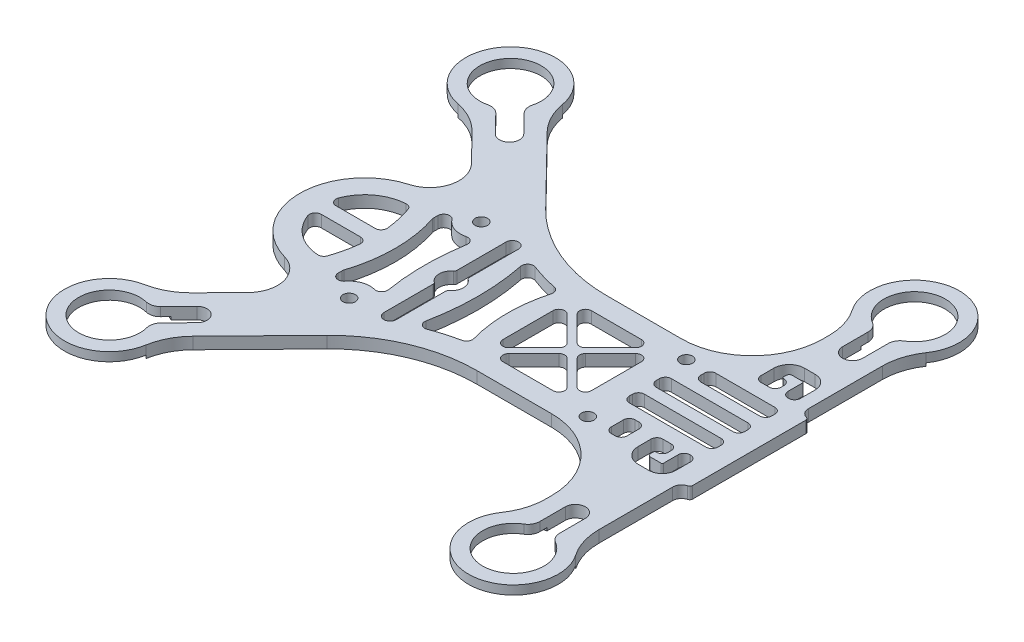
SolidWorks part; units mm, degrees
ref_plane "Plan de face" through (0, 0, 0) normal (0, 0, 1) x (1, 0, 0)
ref_plane "Plan de dessus" through (0, 0, 0) normal (0, 1, 0) x (1, 0, 0)
ref_plane "Plan de droite" through (0, 0, 0) normal (1, 0, 0) x (0, 0, -1)
sketch "Esquisse1" plane through (0, 0, 0) normal (0, 1, 0) x (1, 0, 0)
  line L0 (1870.1298, 1169.8498) -> (1870.1298, 1174.1732)
  line L1 (1866.7298, 1174.1732) -> (1866.7298, 1169.8498)
  line L2 (1803.0538, 1169.2774) -> (1806.0769, 1172.3681)
  line L3 (1808.5075, 1169.9907) -> (1805.4843, 1166.9)
  line L4 (1810.1424, 1227.6886) -> (1821.3877, 1216.192)
  line L5 (1839.2596, 1208.6732) -> (1851.9298, 1208.6732)
  line L6 (1863.9298, 1220.6732) -> (1863.9298, 1221.6977)
  line L7 (1872.9298, 1221.6977) -> (1872.9298, 1209.1732)
  line L8 (1874.3956, 1207.2459) -> (1874.3956, 1197.6732)
  line L9 (1874.3956, 1197.6732) -> (1874.3956, 1188.1006)
  line L10 (1872.9298, 1186.1732) -> (1872.9298, 1173.6487)
  line L11 (1863.9298, 1173.6487) -> (1863.9298, 1174.6732)
  line L12 (1851.9298, 1186.6732) -> (1839.2596, 1186.6732)
  line L13 (1821.3877, 1179.1545) -> (1810.1424, 1167.6578)
  line L14 (1803.7085, 1173.9511) -> (1808.4335, 1178.7817)
  line L15 (1808.4335, 1216.5647) -> (1803.7085, 1221.3953)
  line L16 (1870.1298, 1225.4966) -> (1870.1298, 1221.1732)
  line L17 (1866.7298, 1221.1732) -> (1866.7298, 1225.4966)
  line L18 (1803.0538, 1226.069) -> (1806.0769, 1222.9783)
  line L19 (1808.5075, 1225.3557) -> (1805.4843, 1228.4464)
  line L20 (1864.0564, 1212.1905) -> (1864.0564, 1210.0077)
  line L21 (1865.0564, 1209.0077) -> (1866.4564, 1209.0077)
  line L22 (1867.4564, 1210.0077) -> (1867.4564, 1210.4905)
  line L23 (1866.4564, 1211.4905) -> (1866.3564, 1211.4905)
  line L24 (1866.1564, 1211.6905) -> (1866.1564, 1212.1905)
  line L25 (1866.6564, 1212.6905) -> (1868.4564, 1212.6905)
  line L26 (1868.6564, 1212.4905) -> (1868.6564, 1210.0077)
  line L27 (1869.6564, 1209.0077) -> (1869.7564, 1209.0077)
  line L28 (1870.7564, 1210.0077) -> (1870.7564, 1212.4905)
  line L29 (1868.4564, 1214.7905) -> (1866.6564, 1214.7905)
  line L30 (1864.0564, 1189.1905) -> (1864.0564, 1191.3732)
  line L31 (1865.0564, 1192.3732) -> (1866.4564, 1192.3732)
  line L32 (1867.4564, 1191.3732) -> (1867.4564, 1190.8905)
  line L33 (1866.4564, 1189.8905) -> (1866.3564, 1189.8905)
  line L34 (1866.1564, 1189.6905) -> (1866.1564, 1189.1905)
  line L35 (1866.6564, 1188.6905) -> (1868.4564, 1188.6905)
  line L36 (1868.6564, 1188.8905) -> (1868.6564, 1191.3732)
  line L37 (1869.6564, 1192.3732) -> (1869.7564, 1192.3732)
  line L38 (1870.7564, 1191.3732) -> (1870.7564, 1188.8905)
  line L39 (1868.4564, 1186.5905) -> (1866.6564, 1186.5905)
  line L40 (1840.1584, 1190.1732) -> (1848.6329, 1190.1732)
  line L41 (1849.34, 1191.8803) -> (1845.1028, 1196.1176)
  line L42 (1843.6885, 1196.1176) -> (1839.4513, 1191.8803)
  line L43 (1850.1885, 1192.7288) -> (1845.9513, 1196.9661)
  line L44 (1845.9513, 1198.3803) -> (1850.1885, 1202.6176)
  line L45 (1851.8956, 1201.9105) -> (1851.8956, 1193.4359)
  line L46 (1840.1584, 1205.1732) -> (1848.6329, 1205.1732)
  line L47 (1849.34, 1203.4661) -> (1845.1028, 1199.2288)
  line L48 (1843.6885, 1199.2288) -> (1839.4513, 1203.4661)
  line L49 (1838.6028, 1192.7288) -> (1842.84, 1196.9661)
  line L50 (1842.84, 1198.3803) -> (1838.6028, 1202.6176)
  line L51 (1836.8956, 1201.9105) -> (1836.8956, 1193.4359)
  line L52 (1870.8956, 1200.4105) -> (1870.8956, 1200.9705)
  line L53 (1869.8956, 1201.9705) -> (1856.8956, 1201.9705)
  line L54 (1855.8956, 1200.9705) -> (1855.8956, 1200.4105)
  line L55 (1856.8956, 1199.4105) -> (1869.8956, 1199.4105)
  line L56 (1870.8956, 1195.8505) -> (1870.8956, 1196.4105)
  line L57 (1869.8956, 1197.4105) -> (1856.8956, 1197.4105)
  line L58 (1855.8956, 1196.4105) -> (1855.8956, 1195.8505)
  line L59 (1856.8956, 1194.8505) -> (1869.8956, 1194.8505)
  line L60 (1870.8956, 1205.5305) -> (1870.8956, 1204.9705)
  line L61 (1869.8956, 1203.9705) -> (1859.8956, 1203.9705)
  line L62 (1858.8956, 1204.9705) -> (1858.8956, 1205.5305)
  line L63 (1859.8956, 1206.5305) -> (1869.8956, 1206.5305)
  line L64 (1861.5564, 1191.8505) -> (1861.5564, 1189.8159)
  line L65 (1858.8956, 1191.8505) -> (1858.8956, 1189.8159)
  line L66 (1860.5564, 1188.8159) -> (1859.8956, 1188.8159)
  line L67 (1860.5564, 1192.8505) -> (1859.8956, 1192.8505)
  line L68 (1824.9456, 1199.6981) -> (1824.9456, 1208.0285)
  line L69 (1822.8456, 1208.0285) -> (1822.8456, 1199.6981)
  line L70 (1822.8456, 1195.6484) -> (1822.8456, 1187.3179)
  line L71 (1824.9456, 1187.3179) -> (1824.9456, 1195.6484)
  line L72 (1813.1756, 1189.8879) -> (1813.1756, 1189.2296)
  line L73 (1813.1756, 1206.1168) -> (1813.1756, 1205.4585)
  line L74 (1803.118, 1196.4233) -> (1809.7679, 1196.4237)
  line L75 (1803.118, 1198.9231) -> (1809.7679, 1198.9227)
  arc A0 (1870.1298, 1174.1732) -> (1866.7298, 1174.1732) centre (1868.4298, 1174.1732) ccw
  arc A1 (1865.7576, 1168.1341) -> (1866.7298, 1169.8498) centre (1864.7298, 1169.8498) ccw
  arc A2 (1865.7576, 1168.1341) -> (1871.102, 1168.1341) centre (1868.4298, 1163.6732) ccw
  arc A3 (1870.1298, 1169.8498) -> (1871.102, 1168.1341) centre (1872.1298, 1169.8498) ccw
  arc A4 (1808.5075, 1169.9907) -> (1806.0769, 1172.3681) centre (1807.2922, 1171.1794) ccw
  arc A5 (1805.4843, 1166.9) -> (1804.9796, 1164.9936) centre (1806.9141, 1165.5015) ccw
  arc A6 (1801.159, 1168.7307) -> (1804.9796, 1164.9936) centre (1799.9501, 1163.6732) ccw
  arc A7 (1801.159, 1168.7307) -> (1803.0538, 1169.2774) centre (1801.624, 1170.6759) ccw
  arc A8 (1803.7085, 1221.3953) -> (1798.4861, 1224.2155) centre (1796.5597, 1214.4028) ccw
  arc A9 (1807.4383, 1232.9721) -> (1798.4861, 1224.2155) centre (1799.9501, 1231.6732) ccw
  arc A10 (1807.4383, 1232.9721) -> (1810.1424, 1227.6886) centre (1817.2911, 1234.6811) ccw
  arc A11 (1821.3877, 1216.192) -> (1839.2596, 1208.6732) centre (1839.2596, 1233.6732) ccw
  arc A12 (1851.9298, 1208.6732) -> (1863.9298, 1220.6732) centre (1851.9298, 1220.6732) ccw
  arc A13 (1863.9298, 1221.6977) -> (1862.1684, 1227.3656) centre (1853.9298, 1221.6977) ccw
  arc A14 (1874.6912, 1227.3656) -> (1862.1684, 1227.3656) centre (1868.4298, 1231.6732) ccw
  arc A15 (1874.6912, 1227.3656) -> (1872.9298, 1221.6977) centre (1882.9298, 1221.6977) ccw
  arc A16 (1872.9298, 1209.1732) -> (1874.0292, 1207.7277) centre (1874.4298, 1209.1732) ccw
  arc A17 (1874.3956, 1207.2459) -> (1874.0292, 1207.7277) centre (1873.8956, 1207.2459) ccw
  arc A18 (1874.0292, 1187.6187) -> (1874.3956, 1188.1006) centre (1873.8956, 1188.1006) ccw
  arc A19 (1874.0292, 1187.6187) -> (1872.9298, 1186.1732) centre (1874.4298, 1186.1732) ccw
  arc A20 (1872.9298, 1173.6487) -> (1874.6912, 1167.9808) centre (1882.9298, 1173.6487) ccw
  arc A21 (1862.1684, 1167.9808) -> (1874.6912, 1167.9808) centre (1868.4298, 1163.6732) ccw
  arc A22 (1862.1684, 1167.9808) -> (1863.9298, 1173.6487) centre (1853.9298, 1173.6487) ccw
  arc A23 (1863.9298, 1174.6732) -> (1851.9298, 1186.6732) centre (1851.9298, 1174.6732) ccw
  arc A24 (1839.2596, 1186.6732) -> (1821.3877, 1179.1545) centre (1839.2596, 1161.6732) ccw
  arc A25 (1810.1424, 1167.6578) -> (1807.4383, 1162.3743) centre (1817.2911, 1160.6653) ccw
  arc A26 (1798.4861, 1171.1309) -> (1807.4383, 1162.3743) centre (1799.9501, 1163.6732) ccw
  arc A27 (1798.4861, 1171.1309) -> (1803.7085, 1173.9511) centre (1796.5597, 1180.9436) ccw
  arc A28 (1808.4335, 1178.7817) -> (1806.2207, 1187.0889) centre (1804.8591, 1182.2779) ccw
  arc A29 (1806.2207, 1208.2575) -> (1806.2207, 1187.0889) centre (1809.2163, 1197.6732) ccw
  arc A30 (1806.2207, 1208.2575) -> (1808.4335, 1216.5647) centre (1804.8591, 1213.0685) ccw
  arc A31 (1866.7298, 1221.1732) -> (1870.1298, 1221.1732) centre (1868.4298, 1221.1732) ccw
  arc A32 (1866.7298, 1225.4966) -> (1865.7576, 1227.2124) centre (1864.7298, 1225.4966) ccw
  arc A33 (1871.102, 1227.2124) -> (1865.7576, 1227.2124) centre (1868.4298, 1231.6732) ccw
  arc A34 (1871.102, 1227.2124) -> (1870.1298, 1225.4966) centre (1872.1298, 1225.4966) ccw
  arc A35 (1806.0769, 1222.9783) -> (1808.5075, 1225.3557) centre (1807.2922, 1224.167) ccw
  arc A36 (1804.9796, 1230.3528) -> (1805.4843, 1228.4464) centre (1806.9141, 1229.8449) ccw
  arc A37 (1804.9796, 1230.3528) -> (1801.159, 1226.6157) centre (1799.9501, 1231.6732) ccw
  arc A38 (1803.0538, 1226.069) -> (1801.159, 1226.6157) centre (1801.624, 1224.6705) ccw
  arc A39 (1864.0564, 1210.0077) -> (1865.0564, 1209.0077) centre (1865.0564, 1210.0077) ccw
  arc A40 (1866.4564, 1209.0077) -> (1867.4564, 1210.0077) centre (1866.4564, 1210.0077) ccw
  arc A41 (1867.4564, 1210.4905) -> (1866.4564, 1211.4905) centre (1866.4564, 1210.4905) ccw
  arc A42 (1866.1564, 1211.6905) -> (1866.3564, 1211.4905) centre (1866.3564, 1211.6905) ccw
  arc A43 (1866.6564, 1212.6905) -> (1866.1564, 1212.1905) centre (1866.6564, 1212.1905) ccw
  arc A44 (1868.6564, 1212.4905) -> (1868.4564, 1212.6905) centre (1868.4564, 1212.4905) ccw
  arc A45 (1868.6564, 1210.0077) -> (1869.6564, 1209.0077) centre (1869.6564, 1210.0077) ccw
  arc A46 (1869.7564, 1209.0077) -> (1870.7564, 1210.0077) centre (1869.7564, 1210.0077) ccw
  arc A47 (1870.7564, 1212.4905) -> (1868.4564, 1214.7905) centre (1868.4564, 1212.4905) ccw
  arc A48 (1866.6564, 1214.7905) -> (1864.0564, 1212.1905) centre (1866.6564, 1212.1905) ccw
  arc A49 (1865.0564, 1192.3732) -> (1864.0564, 1191.3732) centre (1865.0564, 1191.3732) ccw
  arc A50 (1867.4564, 1191.3732) -> (1866.4564, 1192.3732) centre (1866.4564, 1191.3732) ccw
  arc A51 (1866.4564, 1189.8905) -> (1867.4564, 1190.8905) centre (1866.4564, 1190.8905) ccw
  arc A52 (1866.3564, 1189.8905) -> (1866.1564, 1189.6905) centre (1866.3564, 1189.6905) ccw
  arc A53 (1866.1564, 1189.1905) -> (1866.6564, 1188.6905) centre (1866.6564, 1189.1905) ccw
  arc A54 (1868.4564, 1188.6905) -> (1868.6564, 1188.8905) centre (1868.4564, 1188.8905) ccw
  arc A55 (1869.6564, 1192.3732) -> (1868.6564, 1191.3732) centre (1869.6564, 1191.3732) ccw
  arc A56 (1870.7564, 1191.3732) -> (1869.7564, 1192.3732) centre (1869.7564, 1191.3732) ccw
  arc A57 (1868.4564, 1186.5905) -> (1870.7564, 1188.8905) centre (1868.4564, 1188.8905) ccw
  arc A58 (1864.0564, 1189.1905) -> (1866.6564, 1186.5905) centre (1866.6564, 1189.1905) ccw
  circle A59 centre (1855.3956, 1189.3232) radius 1.05
  circle A60 centre (1855.3956, 1206.0232) radius 1.05
  circle A61 centre (1817.7956, 1186.4732) radius 1.05
  circle A62 centre (1817.7956, 1208.8732) radius 1.05
  arc A63 (1848.6329, 1190.1732) -> (1849.34, 1191.8803) centre (1848.6329, 1191.1732) ccw
  arc A64 (1845.1028, 1196.1176) -> (1843.6885, 1196.1176) centre (1844.3956, 1195.4105) ccw
  arc A65 (1839.4513, 1191.8803) -> (1840.1584, 1190.1732) centre (1840.1584, 1191.1732) ccw
  arc A66 (1850.1885, 1192.7288) -> (1851.8956, 1193.4359) centre (1850.8956, 1193.4359) ccw
  arc A67 (1845.9513, 1198.3803) -> (1845.9513, 1196.9661) centre (1846.6584, 1197.6732) ccw
  arc A68 (1851.8956, 1201.9105) -> (1850.1885, 1202.6176) centre (1850.8956, 1201.9105) ccw
  arc A69 (1849.34, 1203.4661) -> (1848.6329, 1205.1732) centre (1848.6329, 1204.1732) ccw
  arc A70 (1843.6885, 1199.2288) -> (1845.1028, 1199.2288) centre (1844.3956, 1199.9359) ccw
  arc A71 (1840.1584, 1205.1732) -> (1839.4513, 1203.4661) centre (1840.1584, 1204.1732) ccw
  arc A72 (1836.8956, 1193.4359) -> (1838.6028, 1192.7288) centre (1837.8956, 1193.4359) ccw
  arc A73 (1842.84, 1196.9661) -> (1842.84, 1198.3803) centre (1842.1329, 1197.6732) ccw
  arc A74 (1838.6028, 1202.6176) -> (1836.8956, 1201.9105) centre (1837.8956, 1201.9105) ccw
  arc A75 (1870.8956, 1200.9705) -> (1869.8956, 1201.9705) centre (1869.8956, 1200.9705) ccw
  arc A76 (1856.8956, 1201.9705) -> (1855.8956, 1200.9705) centre (1856.8956, 1200.9705) ccw
  arc A77 (1855.8956, 1200.4105) -> (1856.8956, 1199.4105) centre (1856.8956, 1200.4105) ccw
  arc A78 (1869.8956, 1199.4105) -> (1870.8956, 1200.4105) centre (1869.8956, 1200.4105) ccw
  arc A79 (1870.8956, 1196.4105) -> (1869.8956, 1197.4105) centre (1869.8956, 1196.4105) ccw
  arc A80 (1856.8956, 1197.4105) -> (1855.8956, 1196.4105) centre (1856.8956, 1196.4105) ccw
  arc A81 (1855.8956, 1195.8505) -> (1856.8956, 1194.8505) centre (1856.8956, 1195.8505) ccw
  arc A82 (1869.8956, 1194.8505) -> (1870.8956, 1195.8505) centre (1869.8956, 1195.8505) ccw
  arc A83 (1869.8956, 1203.9705) -> (1870.8956, 1204.9705) centre (1869.8956, 1204.9705) ccw
  arc A84 (1858.8956, 1204.9705) -> (1859.8956, 1203.9705) centre (1859.8956, 1204.9705) ccw
  arc A85 (1859.8956, 1206.5305) -> (1858.8956, 1205.5305) centre (1859.8956, 1205.5305) ccw
  arc A86 (1870.8956, 1205.5305) -> (1869.8956, 1206.5305) centre (1869.8956, 1205.5305) ccw
  arc A87 (1860.5564, 1188.8159) -> (1861.5564, 1189.8159) centre (1860.5564, 1189.8159) ccw
  arc A88 (1859.8956, 1192.8505) -> (1858.8956, 1191.8505) centre (1859.8956, 1191.8505) ccw
  arc A89 (1858.8956, 1189.8159) -> (1859.8956, 1188.8159) centre (1859.8956, 1189.8159) ccw
  arc A90 (1861.5564, 1191.8505) -> (1860.5564, 1192.8505) centre (1860.5564, 1191.8505) ccw
  arc A91 (1825.1417, 1196.0454) -> (1824.9456, 1195.6484) centre (1825.4456, 1195.6484) ccw
  arc A92 (1825.1417, 1196.0454) -> (1825.1417, 1199.301) centre (1823.8956, 1197.6732) ccw
  arc A93 (1824.9456, 1199.6981) -> (1825.1417, 1199.301) centre (1825.4456, 1199.6981) ccw
  arc A94 (1824.9456, 1208.0285) -> (1822.8456, 1208.0285) centre (1823.8956, 1208.0285) ccw
  arc A95 (1822.6496, 1199.301) -> (1822.8456, 1199.6981) centre (1822.3456, 1199.6981) ccw
  arc A96 (1822.6496, 1199.301) -> (1822.6496, 1196.0454) centre (1823.8956, 1197.6732) ccw
  arc A97 (1822.8456, 1195.6484) -> (1822.6496, 1196.0454) centre (1822.3456, 1195.6484) ccw
  arc A98 (1822.8456, 1187.3179) -> (1824.9456, 1187.3179) centre (1823.8956, 1187.3179) ccw
  arc A99 (1834.2839, 1204.256) -> (1833.5196, 1205.502) centre (1833.32, 1204.5222) ccw
  arc A100 (1828.9857, 1206.8216) -> (1833.5196, 1205.502) centre (1839.2596, 1233.6732) ccw
  arc A101 (1828.9857, 1206.8216) -> (1827.6479, 1205.6906) centre (1828.6283, 1205.8877) ccw
  arc A102 (1827.6479, 1189.6558) -> (1827.6479, 1205.6906) centre (1787.7592, 1197.6732) ccw
  arc A103 (1827.6479, 1189.6558) -> (1828.9857, 1188.5248) centre (1828.6283, 1189.4588) ccw
  arc A104 (1833.5339, 1189.8473) -> (1828.9857, 1188.5248) centre (1839.2596, 1161.6732) ccw
  arc A105 (1833.5339, 1189.8473) -> (1834.2981, 1191.0955) centre (1833.3347, 1190.8272) ccw
  arc A106 (1834.2839, 1204.256) -> (1834.2981, 1191.0955) centre (1858.0242, 1197.7013) ccw
  arc A107 (1813.2232, 1190.1928) -> (1813.1756, 1189.8879) centre (1814.1756, 1189.8879) ccw
  arc A108 (1813.1756, 1189.2296) -> (1814.9712, 1188.6238) centre (1814.1756, 1189.2296) ccw
  arc A109 (1818.6587, 1189.9167) -> (1814.9712, 1188.6238) centre (1817.7956, 1186.4732) ccw
  arc A110 (1818.6587, 1189.9167) -> (1819.8884, 1191.0495) centre (1818.9018, 1190.8867) ccw
  arc A111 (1819.8884, 1204.2969) -> (1819.8884, 1191.0495) centre (1860.0321, 1197.6732) ccw
  arc A112 (1819.8884, 1204.2969) -> (1818.6587, 1205.4297) centre (1818.9018, 1204.4597) ccw
  arc A113 (1814.9712, 1206.7226) -> (1818.6587, 1205.4297) centre (1817.7956, 1208.8732) ccw
  arc A114 (1814.9712, 1206.7226) -> (1813.1756, 1206.1168) centre (1814.1756, 1206.1168) ccw
  arc A115 (1813.1756, 1205.4585) -> (1813.2232, 1205.1536) centre (1814.1756, 1205.4585) ccw
  arc A116 (1813.2232, 1190.1928) -> (1813.2232, 1205.1536) centre (1789.9357, 1197.6732) ccw
  arc A117 (1803.118, 1196.4233) -> (1802.1799, 1195.0771) centre (1803.1181, 1195.4233) ccw
  arc A118 (1810.7616, 1195.311) -> (1809.7679, 1196.4237) centre (1809.768, 1195.4237) ccw
  arc A119 (1809.7571, 1190.8608) -> (1810.7616, 1195.311) centre (1789.9357, 1197.6732) ccw
  arc A120 (1808.7492, 1190.1878) -> (1809.7571, 1190.8608) centre (1808.8114, 1191.1858) ccw
  arc A121 (1802.1799, 1195.0771) -> (1808.7492, 1190.1878) centre (1809.2163, 1197.6732) ccw
  arc A122 (1802.1799, 1200.2693) -> (1803.118, 1198.9231) centre (1803.1181, 1199.9231) ccw
  arc A123 (1809.7679, 1198.9227) -> (1810.7616, 1200.0354) centre (1809.768, 1199.9227) ccw
  arc A124 (1810.7616, 1200.0354) -> (1809.7571, 1204.4856) centre (1789.9357, 1197.6732) ccw
  arc A125 (1809.7571, 1204.4856) -> (1808.7492, 1205.1586) centre (1808.8114, 1204.1606) ccw
  arc A126 (1808.7492, 1205.1586) -> (1802.1799, 1200.2693) centre (1809.2163, 1197.6732) ccw
  point P298 (1834.6157, 1190.0457)
  point P299 (1813.1756, 1190.0457)
  point P300 (1813.1756, 1205.3007)
extrude "Boss.-Extru.1" add sketch "Esquisse1" along normal blind 2
sketch "Esquisse3" plane through (0, 0, 0) normal (0, -1, 0) x (1, 0, 0)
  circle A0 centre (1799.9501, -1163.6732) radius 7.6
  circle A1 centre (1868.4298, -1163.6732) radius 7.6
  circle A2 centre (1799.9501, -1231.6732) radius 7.6
  circle A3 centre (1868.4298, -1231.6732) radius 7.6
  arc A4 (1807.4383, -1162.3743) -> (1798.4861, -1171.1309) centre (1799.9501, -1163.6732) ccw construction
extrude "Enlèv. mat.-Extru.2" cut sketch "Esquisse3" against normal blind 0.5
